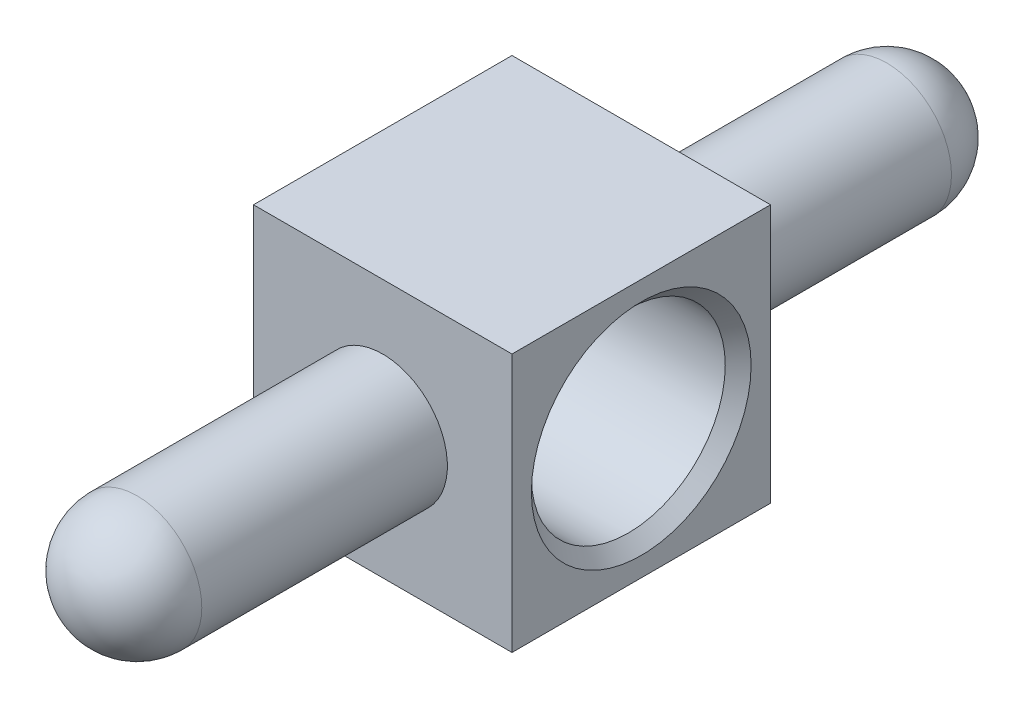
SolidWorks part; units mm, degrees
ref_plane "Front Plane" through (0, 0, 0) normal (0, 0, 1) x (1, 0, 0)
ref_plane "Top Plane" through (0, 0, 0) normal (0, 1, 0) x (1, 0, 0)
ref_plane "Right Plane" through (0, 0, 0) normal (1, 0, 0) x (0, 0, -1)
sketch "Sketch1" plane through (0, 0, 0) normal (0, 1, 0) x (1, 0, 0)
  line L1 (0, 0) -> (25.4, 0)
  line L2 (0, 0) -> (0, -25.4)
  line L3 (0, -25.4) -> (25.4, -25.4)
  line L4 (25.4, 0) -> (25.4, -25.4)
  dimension "D1" = 25.4
  dimension "D2" = 25.4
extrude "Boss-Extrude1" add sketch "Sketch1" along normal blind 25.4
sketch "Sketch2" plane through (25.4, 0, 0) normal (1, 0, 0) x (0, 0, -1)
  line L0 (-12.7, 25.4) -> (-12.7, 0) construction
  line L1 (-25.4, 25.4) -> (0, 25.4) construction
  line L2 (-25.4, 0) -> (0, 0) construction
  line L3 (0, 12.7) -> (-25.4, 12.7) construction
  line L4 (0, 25.4) -> (0, 0) construction
  line L5 (-25.4, 25.4) -> (-25.4, 0) construction
  circle A0 centre (-12.7, 12.7) radius 9.525
extrude "Cut-Extrude1" cut sketch "Sketch2" against normal blind 25.4
chamfer "Chamfer1" distance 1.27 angle 45 1 edges at (25.4, 12.7, 3.175)
chamfer "Chamfer2" distance 1.27 angle 45 1 edges at (0, 12.7, 3.175)
sketch "Sketch3" plane through (0, 0, 0) normal (0, 0, -1) x (-1, 0, 0)
  line L0 (-25.4, 12.7) -> (0, 12.7) construction
  line L1 (-25.4, 25.4) -> (-25.4, 0) construction
  line L2 (0, 25.4) -> (0, 0) construction
  circle A0 centre (-12.7, 12.7) radius 6.35
extrude "Boss-Extrude2" add sketch "Sketch3" along normal blind 24.13
sketch "Sketch4" plane through (0, 0, 25.4) normal (0, 0, 1) x (1, 0, 0)
  line L0 (0, 12.7) -> (25.4, 12.7) construction
  line L1 (0, 25.4) -> (0, 0) construction
  line L2 (25.4, 25.4) -> (25.4, 0) construction
  circle A0 centre (12.7, 12.7) radius 6.35
extrude "Boss-Extrude3" add sketch "Sketch4" along normal blind 24.13
sketch "Sketch5" plane through (0, 0, -24.13) normal (0, 0, -1) x (-1, 0, 0)
  line L0 (-6.35, 12.7) -> (-19.05, 12.7)
  circle A0 centre (-12.7, 12.7) radius 6.35 construction
  arc A1 (-6.35, 12.7) -> (-19.05, 12.7) centre (-12.7, 12.7) cw
revolve "Revolve1" add sketch "Sketch5" angle 360 about L0
sketch "Sketch6" plane through (0, 0, 49.53) normal (0, 0, 1) x (1, 0, 0)
  line L0 (12.7, 6.35) -> (12.7, 19.05)
  circle A0 centre (12.7, 12.7) radius 6.35 construction
  arc A1 (12.7, 19.05) -> (12.7, 6.35) centre (12.7, 12.7) ccw
revolve "Revolve2" add sketch "Sketch6" angle 360 about L0
